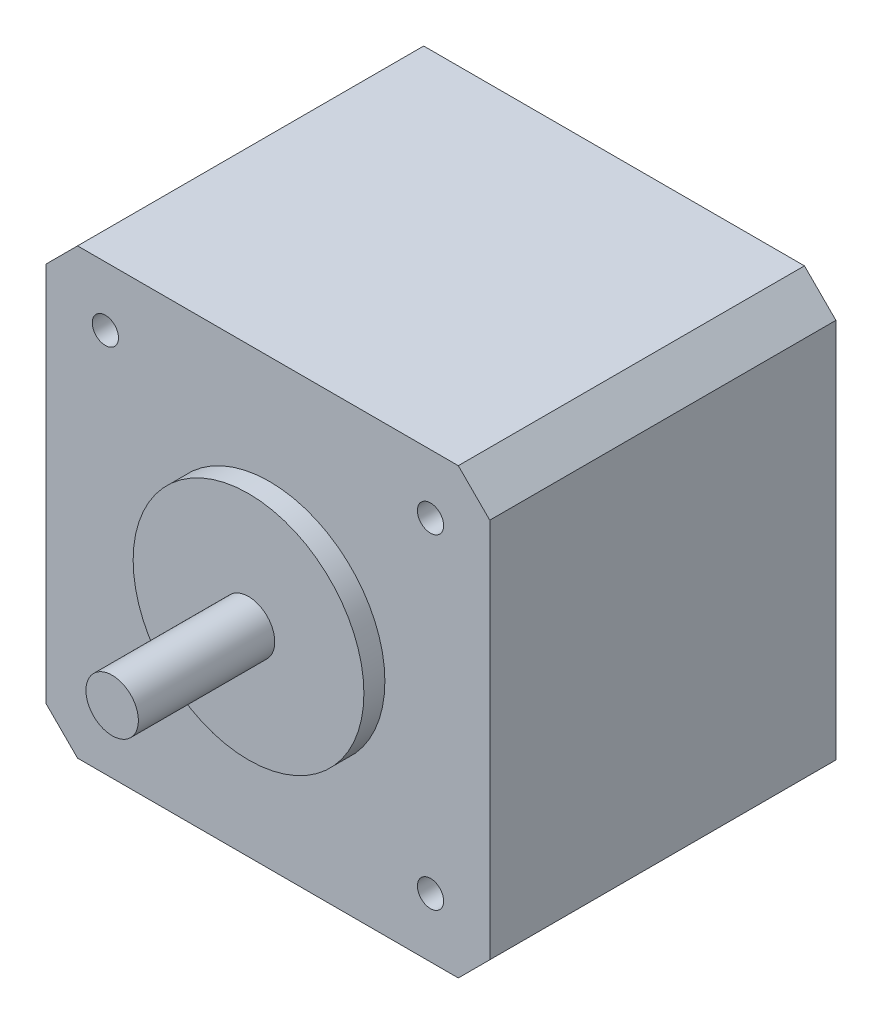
SolidWorks part; units mm, degrees
ref_plane "Alzado" through (0, 0, 0) normal (0, 0, 1) x (1, 0, 0)
ref_plane "Planta" through (0, 0, 0) normal (0, 1, 0) x (1, 0, 0)
ref_plane "Vista lateral" through (0, 0, 0) normal (1, 0, 0) x (0, 0, -1)
ref_plane "Plano1" through (0, 0, 33) normal (0, 0, 1) x (1, 0, 0)
sketch "Croquis1" plane through (0, 0, 33) normal (0, 0, 1) x (1, 0, 0)
  line L0 (0, 42.3) -> (-42.3, 42.3)
  line L1 (-42.3, 42.3) -> (-42.3, 0)
  line L2 (-42.3, 0) -> (0, 0)
  line L3 (0, 0) -> (0, 42.3)
extrude "Saliente-Extruir1" add sketch "Croquis1" against normal blind 33
ref_plane "Plano2" through (0, 21, 0) normal (0, -1, 0) x (1, 0, 0)
sketch "Croquis2" plane through (0, 21, 0) normal (0, -1, 0) x (1, 0, 0)
  line L0 (-18.5, 48) -> (-21, 48)
  line L1 (-21, 48) -> (-21, 33)
  line L2 (-21, 33) -> (-10, 33)
  line L3 (-10, 33) -> (-10, 35)
  line L4 (-10, 35) -> (-18.5, 35)
  line L5 (-18.5, 35) -> (-18.5, 48)
  line L6 (-21, 48) -> (-21, 33) construction
revolve "Revolución1" add sketch "Croquis2" angle 360 about L6
hole_wizard "Diámetro de taladro Ø2.5 (2.5)1" positions "Croquis4" profile "Croquis3" hole size "Ø2.5" standard "Ansi Metric"
sketch "Croquis4" plane through (0, 0, 33) normal (0, 0, 1) x (1, 0, 0)
  point P0 (-36.65, 5.65)
  point P1 (-5.65, 36.65)
  point P2 (-5.65, 5.65)
  point P3 (-36.65, 36.65)
sketch "Croquis3" plane through (-36.65, 5.65, 33) normal (1, 0, 0) x (0, -1, 0)
  line L0 (0, 0) -> (0, 5)
  line L1 (0, 5) -> (1.25, 5)
  line L2 (1.25, 5) -> (1.25, 0)
  line L5 (1.25, 0) -> (0, 0)
  line L10 (0, 5) -> (-1.25, 5) construction
  line L11 (0, -6.35) -> (0, 107.95) construction
  dimension "Diámetro de taladro" = 2.5
  dimension "Profundidad de taladro" = 5
  dimension "Ángulo de perforador" = 180
chamfer "Chaflán1" distance 3 angle 45 4 edges at (-42.3, 42.3, 16.5) (-42.3, 0, 16.5) (0, 42.3, 16.5) (0, 0, 16.5)
